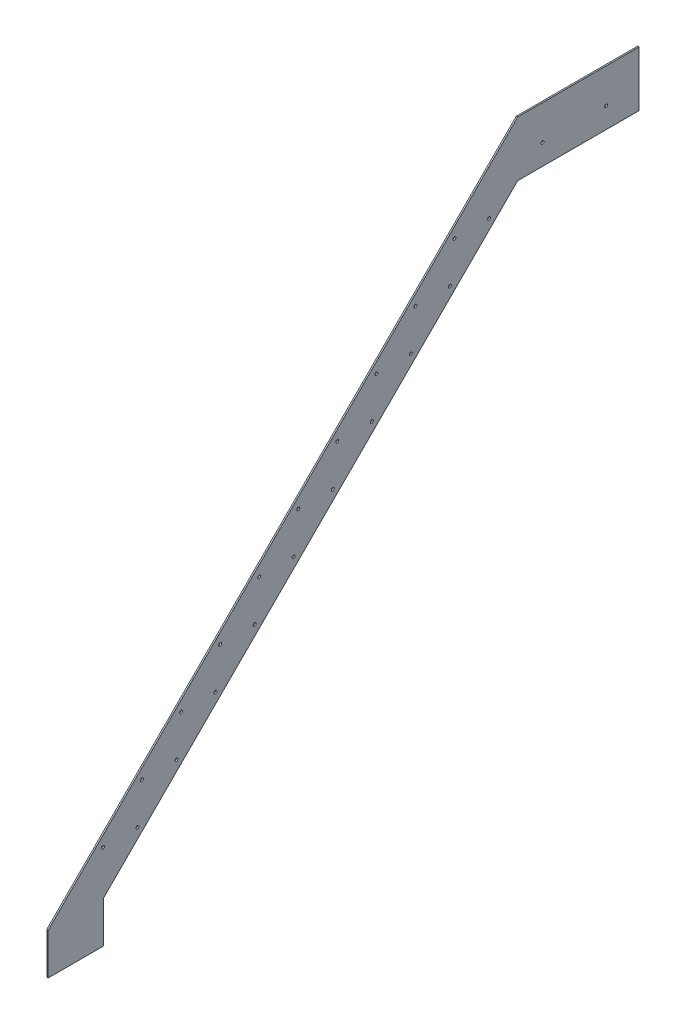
SolidWorks part; units mm, degrees
ref_plane "Vorne" through (0, 0, 0) normal (0, 0, 1) x (1, 0, 0)
ref_plane "Oben" through (0, 0, 0) normal (0, 1, 0) x (1, 0, 0)
ref_plane "Rechts" through (0, 0, 0) normal (1, 0, 0) x (0, 0, -1)
sketch "Skizze1" plane through (0, 0, 0) normal (1, 0, 0) x (0, 0, -1)
  line L0 (0, 0) -> (-440.1256, 0)
  line L1 (-440.1256, 0) -> (-1940.1256, -1500)
  line L2 (-1940.1256, -1500) -> (-1940.1256, -1650)
  line L3 (-1940.1256, -1650) -> (-2140.1256, -1650)
  line L4 (-2140.1256, -1650) -> (-2140.1256, -1500)
  line L5 (-2140.1256, -1500) -> (-440.1256, 200)
  line L6 (-440.1256, 200) -> (0, 200)
  line L7 (0, 200) -> (0, 0)
  dimension "D1" = 141.4214
  dimension "D2" = 200
  dimension "D3" = 150
  dimension "D4" = 1500
sketch "Skizze4" plane through (0, 0, 0) normal (1, 0, 0) x (0, 0, -1)
  line L0 (-857.3647, 822.316) -> (-627.3647, 822.316) construction
  line L1 (-1938.2468, -374.0813) -> (-1813.2468, -374.0813) construction
  line L2 (-1813.2468, -374.0813) -> (-1813.2468, -515.5027) construction
  dimension "Abstand_oben" = 230
  dimension "Abstand_horizontal" = 125
  dimension "Abstand_vertikal" = 141.4214
sheet metal parameters "Blech1" thickness 5 parameters "D1"=5
base flange "Basis-Blech1" sketch "Skizze1" thickness 5 reverse thickness direction no parameters "D1"=5
hole_wizard "Ø10.8 (10.8) Durchmesser Bohrung1" positions "Skizze6" profile "Skizze5" hole size "Ø10.8" standard "DIN"
sketch "Skizze6" plane through (0, 0, 0) normal (1, 0, 0) x (0, 0, -1)
  line L0 (0, 200) -> (-440.1256, 200) construction
  line L1 (0, 0) -> (0, 200) construction
  point P0 (-120, 75)
  point P1 (-350, 75)
  dimension "D1" = 125
  dimension "D2" = 230
  dimension "D3" = 120
sketch "Skizze5" plane through (0, 75, 120) normal (0, 1, 0) x (0, 0, -1)
  line L0 (0, 0) -> (0, 5)
  line L1 (0, 5) -> (5.4, 5)
  line L2 (5.4, 5) -> (5.4, 0)
  line L5 (5.4, 0) -> (0, 0)
  line L11 (0, -6.35) -> (0, 107.95) construction
  dimension "Bohrerdurchmesser" = 10.8
  dimension "Bohrungstiefe" = 5
hole_wizard "Ø10.8 (10.8) Durchmesser Bohrung2" positions "Skizze8" profile "Skizze7" hole size "Ø10.8" standard "DIN"
sketch "Skizze8" plane through (0, 0, 0) normal (1, 0, 0) x (0, 0, -1)
  line L0 (-506.547, -66.4214) -> (-706.547, -66.4214) construction
  line L1 (-1940.1256, -1500) -> (-440.1256, 0) construction
  line L2 (-440.1256, 200) -> (-2140.1256, -1500) construction
  circle A0 centre (-350, 75) radius 5.4 construction
  point P0 (-669.047, -66.4214)
  point P1 (-544.047, -66.4214)
  dimension "D3" = 141.4214
  dimension "D1" = 125
  dimension "D2" = 37.5
sketch "Skizze7" plane through (0, -66.4214, 669.047) normal (0, 1, 0) x (0, 0, -1)
  line L0 (0, 0) -> (0, 5.001)
  line L1 (0, 5.001) -> (5.4, 5.001)
  line L2 (5.4, 5.001) -> (5.4, 0)
  line L5 (5.4, 0) -> (0, 0)
  line L11 (0, -6.35) -> (0, 107.95) construction
  dimension "Bohrerdurchmesser" = 10.8
  dimension "Bohrungstiefe" = 5.001
pattern_linear "Lineares Muster1" count 10 spacing 200 along (0, -0.7071, 0.7071) of "Ø10.8 (10.8) Durchmesser Bohrung2"
flat pattern "Abwicklung1"
sketch "Biegung-Linien1" plane through (0, 0, 0) normal (0, 1, 0) x (-1, 0, 0)
sketch3d "Rahmen1" [suppressed]
  line L0 (184.7261, 417.2072, 0) -> (2339.6117, -1415.4376, 0) construction
  line L1 (-98.7024, 83.9424, 0) -> (2056.1832, -1748.7024, 0) construction
  line L2 (184.7261, 417.2072, 0) -> (-98.7024, 83.9424, 0) construction
  line L3 (2339.6117, -1415.4376, 0) -> (2056.1832, -1748.7024, 0) construction
equation "\"D2@Skizze6\" = \"Abstand_oben@Skizze4\""
equation "\"D3@Skizze8\" = \"Abstand_vertikal@Skizze4\""
equation "\"D1@Skizze8\" = \"Abstand_horizontal@Skizze4\""
equation "\"Abstand_lineares_Muster@Lineares Muster1\" = \"Abstand_vertikal@Skizze4\"* sqr( 2 )"
